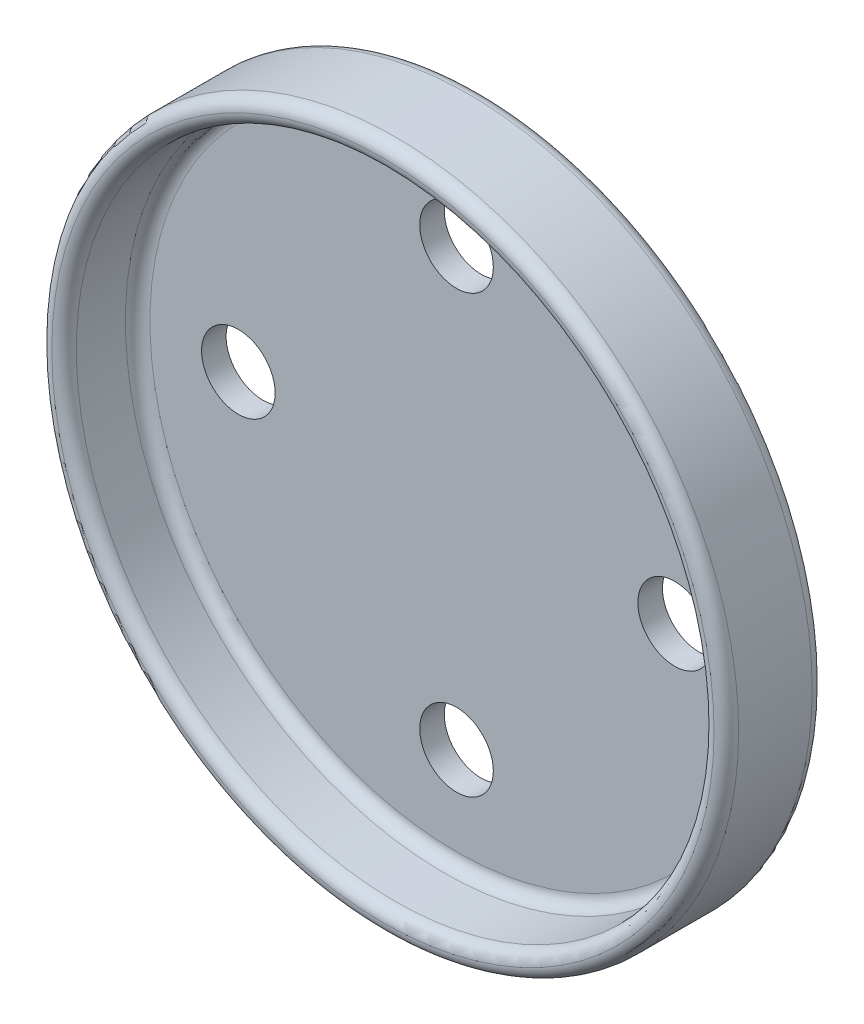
SolidWorks part; units mm, degrees
ref_plane "Plan de face" through (0, 0, 0) normal (0, 0, 1) x (1, 0, 0)
ref_plane "Plan de dessus" through (0, 0, 0) normal (0, 1, 0) x (1, 0, 0)
ref_plane "Plan de droite" through (0, 0, 0) normal (1, 0, 0) x (0, 0, -1)
sketch "Esquisse1" plane through (0, 0, 0) normal (0, 0, 1) x (1, 0, 0)
  circle A0 centre (0, 0) radius 70
  dimension "D1" = 140
extrude "Boss.-Extru.1" add sketch "Esquisse1" along normal blind 20
shell "Coque1" thickness 5
fillet "Congé1" radius 2.5 4 edges at (70, 0, 0) (65, 0, 5) (65, 0, 20) (70, 0, 20)
sketch "Esquisse2" plane through (0, 0, 5) normal (0, 0, 1) x (1, 0, 0)
  line L0 (0, 20.7144) -> (0, -13.4716) construction
  circle A0 centre (-44.475, 0) radius 7.5
  dimension "D1" = 15
  dimension "D2" = 44.475
extrude "Enlèv. mat.-Extru.1" cut sketch "Esquisse2" against normal blind 20
pattern_circular "Répétition circulaire1" count 4 every 90 about axis through (0, 0, 0) along (0, 0, 1) of "Enlèv. mat.-Extru.1"
